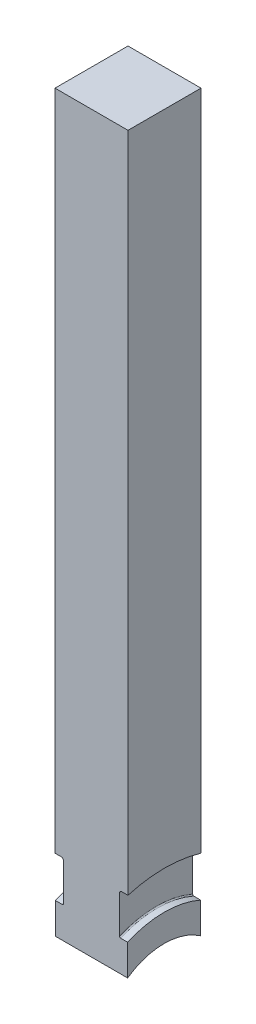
SolidWorks part; units mm, degrees
ref_plane "Front Plane" through (0, 0, 0) normal (0, 0, 1) x (1, 0, 0)
ref_plane "Top Plane" through (0, 0, 0) normal (0, 1, 0) x (1, 0, 0)
ref_plane "Right Plane" through (0, 0, 0) normal (1, 0, 0) x (0, 0, -1)
sketch "Sketch1" plane through (0, 0, 0) normal (1, 0, 0) x (0, 0, -1)
  line L0 (-12.827, 276.225) -> (-12.827, 0)
  line L1 (0, 249.2329) -> (0, 0) construction
  line L2 (12.827, 276.225) -> (12.827, 0)
  line L3 (-12.827, 276.225) -> (12.827, 276.225)
  line L6 (-12.827, 0) -> (12.827, 0)
  arc A0 (-22.225, 0) -> (22.225, 0) centre (0, 0) cw construction
  dimension "R" = 22.225
  dimension "L" = 254
  dimension "T" = 25.654
extrude "Boss-Extrude1" add sketch "Sketch1" along normal mid plane 25.654
sketch "Sketch8" plane through (0, 0, 0) normal (1, 0, 0) x (0, 0, -1)
  circle A0 centre (0, 0) radius 22.225
  arc A1 (22.225, 0) -> (-22.225, 0) centre (0, 0) ccw construction
extrude "Cut-Extrude4" cut sketch "Sketch8" against normal through all both and the other way through all
sketch "Sketch2" plane through (0, 0, 0) normal (0, 0, 1) x (1, 0, 0)
  line L0 (12.827, 31.75) -> (9.8552, 31.75)
  line L1 (12.827, 276.225) -> (12.827, 18.1499) construction
  line L2 (9.8552, 31.75) -> (9.8552, 45.2374)
  line L3 (9.8552, 45.2374) -> (12.827, 45.2374)
  line L4 (12.827, 45.2374) -> (12.827, 31.75)
  line L5 (0, 29.9173) -> (0, 0) construction
  line L6 (-12.827, 45.2374) -> (-12.827, 31.75)
  line L7 (-9.8552, 45.2374) -> (-12.827, 45.2374)
  line L8 (-9.8552, 31.75) -> (-9.8552, 45.2374)
  line L9 (-12.827, 31.75) -> (-9.8552, 31.75)
  line L10 (-8.8482, 0) -> (24.5305, 0) construction
  dimension "D1" = 19.7104
  dimension "D2" = 45.2374
  dimension "D3" = 31.75
revolve "Cut-Revolve1" cut sketch "Sketch2" angle 360 about L10
sketch "Sketch7" plane through (0, 0, 0) normal (0, 0, 1) x (1, 0, 0)
  line L6 (-12.827, 31.75) -> (-12.7, 31.75)
  line L8 (-12.827, 31.75) -> (-12.827, 0)
  line L9 (-12.827, 0) -> (-12.7, 0)
  line L10 (-12.7, 31.75) -> (-12.7, 0)
  line L11 (0, 16.5651) -> (0, 5.9342) construction
  line L12 (12.7, 31.75) -> (12.7, 0)
  line L13 (12.827, 0) -> (12.7, 0)
  line L14 (12.827, 31.75) -> (12.827, 0)
  line L15 (12.827, 31.75) -> (12.7, 31.75)
  dimension "MW" = 25.4
extrude "Cut-Extrude3" cut sketch "Sketch7" against normal through all both and the other way through all
fillet "Fillet1" radius 0.762 2 edges at (-9.8552, 45.2374, 0) (9.8552, 45.2374, 0)
fillet "Fillet2" radius 0.381 2 edges at (-9.8552, 31.75, 0) (9.8552, 31.75, 0)
